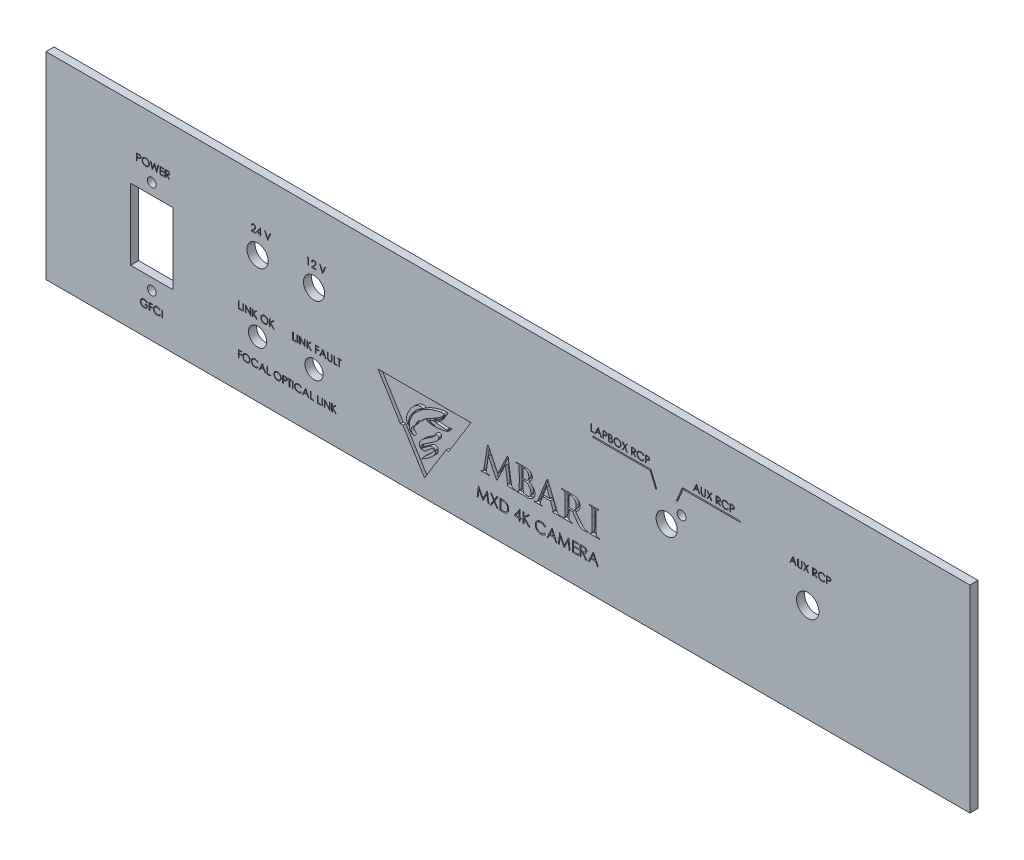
SolidWorks part; units mm, degrees
ref_plane "Front Plane" through (0, 0, 0) normal (0, 0, 1) x (1, 0, 0)
ref_plane "Top Plane" through (0, 0, 0) normal (0, 1, 0) x (1, 0, 0)
ref_plane "Right Plane" through (0, 0, 0) normal (1, 0, 0) x (0, 0, -1)
sketch "Sketch1" plane through (0, 0, 0) normal (0, 0, 1) x (1, 0, 0)
  line L1 (-207.9625, 44.45) -> (207.9625, 44.45)
  line L2 (-207.9625, 44.45) -> (-207.9625, -44.45)
  line L3 (-207.9625, -44.45) -> (207.9625, -44.45)
  line L4 (207.9625, 44.45) -> (207.9625, -44.45)
  line L5 (-207.9625, 44.45) -> (207.9625, -44.45) construction
  line L6 (-207.9625, -44.45) -> (207.9625, 44.45) construction
  point P0 (0, 0)
  dimension "D1" = 88.9
  dimension "D2" = 415.925
extrude "Boss-Extrude1" add sketch "Sketch1" along normal blind 3.6322
sketch "Sketch3" plane through (0, 0, 3.6322) normal (0, 0, 1) x (1, 0, 0)
  line L0 (-207.9625, 0) -> (207.9625, 0) construction
  line L1 (-207.9625, 44.45) -> (-207.9625, -44.45) construction
  line L2 (207.9625, -44.45) -> (207.9625, 44.45) construction
  line L3 (71.4375, 0) -> (84.0984, 12.6609) construction
  line L4 (-169.8625, 12.192) -> (-150.8125, 12.192)
  line L5 (-169.8625, 12.192) -> (-169.8625, -19.812)
  line L6 (-169.8625, -19.812) -> (-150.8125, -19.812)
  line L7 (-150.8125, 12.192) -> (-150.8125, -19.812)
  line L8 (-112.7125, 12.7) -> (-87.3125, 12.7) construction
  line L9 (-207.9625, -44.45) -> (207.9625, -44.45) construction
  line L10 (-112.7125, -19.05) -> (-87.3125, -19.05) construction
  line L11 (-87.3125, -19.05) -> (-87.3125, 12.7) construction
  line L12 (-112.7125, 12.7) -> (-112.7125, -19.05) construction
  line L13 (-169.8625, -3.81) -> (-150.8125, -3.81) construction
  line L14 (-177.6498, 31.623) -> (-140.7405, 31.623) construction
  line L15 (-160.3375, 21.274) -> (-160.3375, -30.0296) construction
  circle A0 centre (-112.7125, 12.7) radius 4.7625
  circle A1 centre (-87.3125, 12.7) radius 4.7625
  circle A2 centre (71.4375, 0) radius 4.7625
  circle A3 centre (78.1727, 6.7352) radius 1.9837
  circle A4 centre (71.4375, 0) radius 9.525 construction
  circle A5 centre (-112.7125, -19.05) radius 4.1021
  circle A6 centre (-87.3125, -19.05) radius 4.1021
  circle A7 centre (-160.3375, -24.892) radius 1.9812
  circle A8 centre (-160.3375, 17.272) radius 1.9812
  dimension "D5" = 9.525
  dimension "D6" = 9.525
  dimension "D9" = 9.525
  dimension "D12" = 3.9675
  dimension "D11" = 19.05
  dimension "D7" = 25.4
  dimension "D17" = 8.2042
  dimension "D18" = 8.2042
  dimension "D21" = 5.08
  dimension "D23" = 3.9624
  dimension "D24" = 3.9624
  dimension "D2" = 32.004
  dimension "D3" = 38.1
  dimension "D4" = 19.05
  dimension "D8" = 95.25
  dimension "D10" = 279.4
  dimension "D13" = 45
  dimension "D14" = 57.15
  dimension "D15" = 76.073
  dimension "D16" = 120.65
  dimension "D19" = 35.433
  dimension "D20" = 9.525
  dimension "D22" = 42.164
extrude "Cut-Extrude2" cut sketch "Sketch3" against normal through all
hole_wizard "X (0.397) Diameter Hole1" positions "Sketch4" profile "Sketch5" hole size "X" standard "ANSI Inch"
sketch "Sketch4" plane through (0, 0, 3.6322) normal (0, 0, 1) x (1, 0, 0)
  line L0 (-207.9625, 44.45) -> (-207.9625, -44.45) construction
  line L1 (-207.9625, 0) -> (207.9625, 0) construction
  line L2 (207.9625, -44.45) -> (207.9625, 44.45) construction
  point P0 (134.9375, 0)
  dimension "D1" = 342.9
sketch "Sketch5" plane through (134.9375, 0, 3.6322) normal (1, 0, 0) x (0, -1, 0)
  line L0 (0, 0) -> (0, 3.6322)
  line L1 (0, 3.6322) -> (5.0419, 3.6322)
  line L2 (5.0419, 3.6322) -> (5.0419, 0)
  line L5 (5.0419, 0) -> (0, 0)
  line L11 (0, -6.35) -> (0, 107.95) construction
  dimension "Thru Hole Dia." = 10.0838
  dimension "Thru Hole Depth" = 3.6322
sketch "Sketch2" plane through (0, 0, 3.6322) normal (0, 0, 1) x (1, 0, 0)
  line L0 (71.4375, 0) -> (71.4375, 30.1179) construction
  line L1 (75.9161, 11.4761) -> (78.4274, 17.5387)
  line L2 (78.662, 17.6955) -> (104.3712, 17.6955)
  line L6 (76.3854, 11.2817) -> (78.7668, 17.0307)
  line L7 (79.0015, 17.1875) -> (104.3712, 17.1875)
  line L13 (63.8735, 17.1875) -> (38.5038, 17.1875)
  line L14 (66.4896, 11.2817) -> (64.1082, 17.0307)
  line L15 (64.213, 17.6955) -> (38.5038, 17.6955)
  line L16 (66.9589, 11.4761) -> (64.4476, 17.5387)
  circle A0 centre (71.4375, 0) radius 12.319 construction
  circle A1 centre (71.4375, 0) radius 19.05 construction
  arc A2 (75.9161, 11.4761) -> (76.3854, 11.2817) centre (76.1508, 11.3789) ccw
  arc A3 (78.7668, 17.0307) -> (79.0015, 17.1875) centre (79.0015, 16.9335) cw
  arc A4 (78.4274, 17.5387) -> (78.662, 17.6955) centre (78.662, 17.4415) cw
  arc A5 (104.3712, 17.1875) -> (104.3712, 17.6955) centre (104.3712, 17.4415) ccw
  arc A6 (38.5038, 17.1875) -> (38.5038, 17.6955) centre (38.5038, 17.4415) cw
  arc A7 (64.4476, 17.5387) -> (64.213, 17.6955) centre (64.213, 17.4415) ccw
  arc A8 (64.1082, 17.0307) -> (63.8735, 17.1875) centre (63.8735, 16.9335) ccw
  arc A9 (66.9589, 11.4761) -> (66.4896, 11.2817) centre (66.7242, 11.3789) cw
  text T0 "POWER"
  text T1 "24 V"
  text T2 "12 V"
  text T3 "AUX RCP"
  text T4 "AUX RCP"
  text T5 "LAPBOX RCP"
  text T6 "FOCAL OPTICAL LINK"
  text T7 "LINK OK"
  text T8 "LINK FAULT"
  text T9 "GFCI"
  point P26 (78.8317, 17.1875)
  point P29 (78.4923, 17.6955)
  point P37 (64.3827, 17.6955)
  point P38 (64.0433, 17.1875)
  point P40 (-163.4462, -33.1202)
  point P41 (0, 0)
  point P42 (0, 0)
  point P43 (-164.9473, -32.5904)
  point P44 (-165.7421, -33.2085)
  dimension "D1" = 24.638
  dimension "D2" = 38.1
  dimension "D6" = 0.254
  dimension "D3" = 22.5
  dimension "D4" = 0.508
  dimension "D5" = 0.508
extrude "Cut-Extrude1" cut sketch "Sketch2" against normal blind 1.27
sketch "Sketch6" plane through (0, 0, 3.6322) normal (0, 0, 1) x (1, 0, 0)
  line L0 (-8.648, -9.8931) -> (-4.5542, -18.3512)
  line L1 (-4.5542, -18.3512) -> (-0.4751, -9.7882)
  line L2 (0.1248, -9.8931) -> (1.4897, -19.161)
  line L3 (-0.2353, -20.0305) -> (-1.1352, -13.4321)
  line L4 (-1.1352, -13.4321) -> (-1.1953, -13.4321)
  line L5 (-1.1953, -13.4321) -> (-4.4644, -20.2405)
  line L6 (-8.8282, -13.5973) -> (-8.8881, -13.5973)
  line L7 (-8.8881, -13.5973) -> (-9.668, -19.5655)
  line L8 (-10.7925, -19.5955) -> (-9.3079, -9.8184)
  line L9 (6.8754, -15.2919) -> (6.8754, -18.8459)
  line L10 (15.5613, -17.3016) -> (14.7513, -19.446)
  line L11 (15.1262, -20.8257) -> (15.3511, -20.8257)
  line L12 (13.5964, -19.446) -> (17.3606, -10.0284)
  line L13 (20.3904, -20.466) -> (19.1907, -17.2867)
  line L14 (18.8302, -16.3417) -> (17.4808, -12.6377)
  line L15 (17.3158, -12.6377) -> (15.9359, -16.3266)
  line L16 (35.7394, -21.0956) -> (34.3146, -21.0956)
  line L17 (28.9008, -16.4317) -> (27.5962, -16.4018)
  line L18 (27.476, -16.5217) -> (27.476, -16.7317)
  line L19 (39.6901, -14.1071) -> (39.6901, -16.7464)
  line L20 (-32.9372, -13.8237) -> (-32.9538, -13.9526)
  line L21 (-29.3165, -8.6069) -> (-29.1387, -8.7056)
  line L22 (-58.4834, -4.5643) -> (-48.4265, -20.8642)
  line L23 (-48.4265, -20.8642) -> (-47.2843, -20.8642)
  line L24 (-47.2843, -20.8642) -> (-37.5838, -36.5292)
  line L25 (-37.5838, -36.5292) -> (-27.8945, -20.8642)
  line L26 (-27.8945, -20.8642) -> (-26.7161, -20.8642)
  line L27 (-26.7161, -20.8642) -> (-16.6581, -4.5643)
  line L28 (-16.6581, -4.5643) -> (-58.4834, -4.5643)
  line L29 (-28.3688, -7.7097) -> (-28.542, -7.9559)
  line L30 (-37.0478, -13.2405) -> (-38.1851, -14.1243)
  line L31 (-32.2349, -12.228) -> (-32.9745, -12.0092)
  line L32 (-38.8678, -29.7655) -> (-37.2522, -27.8185)
  line L33 (-36.8523, -13.4076) -> (-36.3789, -13.1654)
  line L34 (-32.4053, -12.4742) -> (-27.4749, -12.8568)
  line L35 (-27.2878, -12.5555) -> (-27.0639, -12.8095)
  spline S0 degree 3 poles (-9.3079, -9.8184) (-9.2631, -9.5634) (-9.1731, -9.4283) (-9.0531, -9.4283) knots 0 0 0 0 1 1 1 1
  spline S1 degree 3 poles (-9.0531, -9.4283) (-8.9331, -9.4283) (-8.8433, -9.5033) (-8.648, -9.8931) knots 1 1 1 1 2 2 2 2
  spline S2 degree 3 poles (-0.4751, -9.7882) (-0.37, -9.5483) (-0.2801, -9.4283) (-0.1453, -9.4283) knots 4 4 4 4 5 5 5 5
  spline S3 degree 3 poles (-0.1453, -9.4283) (-0.0103, -9.4283) (0.0796, -9.5784) (0.1248, -9.8931) knots 5 5 5 5 6 6 6 6
  spline S4 degree 3 poles (1.4897, -19.161) (1.6245, -20.1057) (1.7742, -20.5408) (2.2243, -20.6758) knots 7 7 7 7 8 8 8 8
  spline S5 degree 3 poles (2.2243, -20.6758) (2.659, -20.8106) (2.959, -20.8255) (3.1539, -20.8255) knots 8 8 8 8 9 9 9 9
  spline S6 degree 3 poles (3.1539, -20.8255) (3.2892, -20.8255) (3.3939, -20.8406) (3.3939, -20.9306) knots 9 9 9 9 10 10 10 10
  spline S7 degree 3 poles (3.3939, -20.9306) (3.3939, -21.0506) (3.2142, -21.0956) (3.004, -21.0956) knots 10 10 10 10 11 11 11 11
  spline S8 degree 3 poles (3.004, -21.0956) (2.6292, -21.0956) (0.5594, -21.0506) (-0.0404, -21.0054) knots 11 11 11 11 12 12 12 12
  spline S9 degree 3 poles (-0.0404, -21.0054) (-0.3852, -20.9756) (-0.4753, -20.9306) (-0.4753, -20.8406) knots 12 12 12 12 13 13 13 13
  spline S10 degree 3 poles (-0.4753, -20.8406) (-0.4753, -20.7654) (-0.4154, -20.7204) (-0.3101, -20.6756) knots 13 13 13 13 14 14 14 14
  spline S11 degree 3 poles (-0.3101, -20.6756) (-0.2205, -20.6452) (-0.1752, -20.4505) (-0.2353, -20.0305) knots 14 14 14 14 15 15 15 15
  spline S12 degree 3 poles (-4.4644, -20.2405) (-4.8092, -20.9453) (-4.8844, -21.0803) (-5.0194, -21.0803) knots 18 18 18 18 19 19 19 19
  spline S13 degree 3 poles (-5.0194, -21.0803) (-5.1542, -21.0803) (-5.3044, -20.7803) (-5.5441, -20.3306) knots 19 19 19 19 20 20 20 20
  spline S14 degree 3 poles (-5.5441, -20.3306) (-5.904, -19.6407) (-7.0886, -17.346) (-7.2684, -16.9262) knots 20 20 20 20 21 21 21 21
  spline S15 degree 3 poles (-7.2684, -16.9262) (-7.4037, -16.6115) (-8.3034, -14.7218) (-8.8282, -13.5973) knots 21 21 21 21 22 22 22 22
  spline S16 degree 3 poles (-9.668, -19.5655) (-9.6982, -19.8356) (-9.713, -20.0305) (-9.713, -20.2705) knots 24 24 24 24 25 25 25 25
  spline S17 degree 3 poles (-9.713, -20.2705) (-9.713, -20.5554) (-9.5183, -20.6905) (-9.2631, -20.7503) knots 25 25 25 25 26 26 26 26
  spline S18 degree 3 poles (-9.2631, -20.7503) (-8.993, -20.8102) (-8.7832, -20.8251) (-8.6333, -20.8251) knots 26 26 26 26 27 27 27 27
  spline S19 degree 3 poles (-8.6333, -20.8251) (-8.5134, -20.8251) (-8.4083, -20.8552) (-8.4083, -20.9302) knots 27 27 27 27 28 28 28 28
  spline S20 degree 3 poles (-8.4083, -20.9302) (-8.4083, -21.065) (-8.5435, -21.0952) (-8.7682, -21.0952) knots 28 28 28 28 29 29 29 29
  spline S21 degree 3 poles (-8.7682, -21.0952) (-9.3981, -21.0952) (-10.0729, -21.0502) (-10.3428, -21.0502) knots 29 29 29 29 30 30 30 30
  spline S22 degree 3 poles (-10.3428, -21.0502) (-10.6276, -21.0502) (-11.3474, -21.0952) (-11.8272, -21.0952) knots 30 30 30 30 31 31 31 31
  spline S23 degree 3 poles (-11.8272, -21.0952) (-11.9774, -21.0952) (-12.0975, -21.065) (-12.0975, -20.9302) knots 31 31 31 31 32 32 32 32
  spline S24 degree 3 poles (-12.0975, -20.9302) (-12.0975, -20.8552) (-12.0073, -20.8251) (-11.8576, -20.8251) knots 32 32 32 32 33 33 33 33
  spline S25 degree 3 poles (-11.8576, -20.8251) (-11.7376, -20.8251) (-11.6325, -20.8251) (-11.4075, -20.7801) knots 33 33 33 33 34 34 34 34
  spline S26 degree 3 poles (-11.4075, -20.7801) (-10.9877, -20.6903) (-10.8675, -20.1051) (-10.7925, -19.5955) knots 34 34 34 34 35 35 35 35
  spline S27 degree 3 poles (5.0458, -10.9278) (5.0158, -10.4182) (4.8959, -10.1781) (4.4009, -10.0732) knots 1 1 1 1 2 2 2 2
  spline S28 degree 3 poles (4.4009, -10.0732) (4.281, -10.043) (4.0257, -10.0282) (3.8159, -10.0282) knots 2 2 2 2 3 3 3 3
  spline S29 degree 3 poles (3.8159, -10.0282) (3.651, -10.0282) (3.5613, -9.9984) (3.5613, -9.8931) knots 3 3 3 3 4 4 4 4
  spline S30 degree 3 poles (3.5613, -9.8931) (3.5613, -9.7882) (3.666, -9.7583) (3.8909, -9.7583) knots 4 4 4 4 5 5 5 5
  spline S31 degree 3 poles (3.8909, -9.7583) (4.6859, -9.7583) (5.6307, -9.8031) (5.9304, -9.8031) knots 5 5 5 5 6 6 6 6
  spline S32 degree 3 poles (5.9304, -9.8031) (6.6654, -9.8031) (7.2502, -9.7583) (7.7602, -9.7583) knots 6 6 6 6 7 7 7 7
  spline S33 degree 3 poles (7.7602, -9.7583) (10.4743, -9.7583) (10.9544, -11.2128) (10.9544, -12.0075) knots 7 7 7 7 8 8 8 8
  spline S34 degree 3 poles (10.9544, -12.0075) (10.9544, -13.2376) (10.2494, -13.9722) (9.4247, -14.6322) knots 8 8 8 8 9 9 9 9
  spline S35 degree 3 poles (9.4247, -14.6322) (10.6545, -15.052) (12.154, -16.117) (12.154, -17.8715) knots 9 9 9 9 10 10 10 10
  spline S36 degree 3 poles (12.154, -17.8715) (12.154, -19.4761) (10.9093, -21.1406) (8.1499, -21.1406) knots 10 10 10 10 11 11 11 11
  spline S37 degree 3 poles (8.1499, -21.1406) (7.79, -21.1406) (6.4255, -21.0506) (5.9756, -21.0506) knots 11 11 11 11 12 12 12 12
  spline S38 degree 3 poles (5.9756, -21.0506) (5.6305, -21.0506) (4.6857, -21.0956) (4.086, -21.0956) knots 12 12 12 12 13 13 13 13
  spline S39 degree 3 poles (4.086, -21.0956) (3.8909, -21.0956) (3.786, -21.0506) (3.786, -20.9455) knots 13 13 13 13 14 14 14 14
  spline S40 degree 3 poles (3.786, -20.9455) (3.786, -20.8707) (3.8463, -20.8255) (4.0259, -20.8255) knots 14 14 14 14 15 15 15 15
  spline S41 degree 3 poles (4.0259, -20.8255) (4.251, -20.8255) (4.4309, -20.7956) (4.5659, -20.7654) knots 15 15 15 15 16 16 16 16
  spline S42 degree 3 poles (4.5659, -20.7654) (4.8657, -20.7053) (4.9411, -20.3758) (5.0008, -19.9409) knots 16 16 16 16 17 17 17 17
  spline S43 degree 3 poles (5.0008, -19.9409) (5.1789, -18.1604) (5.1174, -14.8189) (5.0458, -10.9278) knots 17 17 17 17 18 18 18 18
  spline S44 degree 3 poles (6.8754, -14.3621) (6.8754, -14.4821) (6.9205, -14.5122) (6.9805, -14.5269) knots 0 0 0 0 1 1 1 1
  spline S45 degree 3 poles (6.9805, -14.5269) (7.1154, -14.5572) (7.3404, -14.5721) (7.6851, -14.5721) knots 1 1 1 1 2 2 2 2
  spline S46 degree 3 poles (7.6851, -14.5721) (8.1802, -14.5721) (8.5098, -14.512) (8.765, -14.2869) knots 2 2 2 2 3 3 3 3
  spline S47 degree 3 poles (8.765, -14.2869) (9.1548, -13.9722) (9.3801, -13.4321) (9.3801, -12.6974) knots 3 3 3 3 4 4 4 4
  spline S48 degree 3 poles (9.3801, -12.6974) (9.3801, -11.6926) (8.7951, -10.3728) (7.5054, -10.3728) knots 4 4 4 4 5 5 5 5
  spline S49 degree 3 poles (7.5054, -10.3728) (7.2954, -10.3728) (7.1606, -10.3728) (7.0105, -10.4029) knots 5 5 5 5 6 6 6 6
  spline S50 degree 3 poles (7.0105, -10.4029) (6.9056, -10.4331) (6.8754, -10.4927) (6.8754, -10.6579) knots 6 6 6 6 7 7 7 7
  spline S51 degree 2 poles (6.8754, -10.6579) (6.8754, -14.3621) (6.8754, -14.3621) knots 7 7 7 8 8 8
  spline S52 degree 3 poles (8.855, -15.5618) (8.5401, -15.3369) (8.1953, -15.232) (7.6103, -15.2019) knots 0 0 0 0 1 1 1 1
  spline S53 degree 3 poles (7.6103, -15.2019) (7.3404, -15.1868) (7.1903, -15.1868) (6.9655, -15.1868) knots 1 1 1 1 2 2 2 2
  spline S54 degree 3 poles (6.9655, -15.1868) (6.9054, -15.1868) (6.8754, -15.2172) (6.8754, -15.2919) knots 2 2 2 2 3 3 3 3
  spline S55 degree 3 poles (6.8754, -18.8459) (6.8754, -19.8358) (6.9205, -20.0906) (7.4005, -20.2856) knots 4 4 4 4 5 5 5 5
  spline S56 degree 3 poles (7.4005, -20.2856) (7.8055, -20.4505) (8.1501, -20.4654) (8.4951, -20.4654) knots 5 5 5 5 6 6 6 6
  spline S57 degree 3 poles (8.4951, -20.4654) (9.1701, -20.4654) (10.3097, -20.1055) (10.3097, -18.5459) knots 6 6 6 6 7 7 7 7
  spline S58 degree 3 poles (10.3097, -18.5459) (10.3095, -17.6165) (9.9948, -16.357) (8.855, -15.5618) knots 7 7 7 7 8 8 8 8
  spline S59 degree 3 poles (15.6961, -17.1817) (15.6212, -17.1817) (15.5908, -17.2116) (15.5613, -17.3016) knots 0 0 0 0 1 1 1 1
  spline S60 degree 3 poles (14.7513, -19.446) (14.6016, -19.8212) (14.5268, -20.1811) (14.5268, -20.3609) knots 2 2 2 2 3 3 3 3
  spline S61 degree 3 poles (14.5268, -20.3609) (14.5268, -20.631) (14.6614, -20.8257) (15.1262, -20.8257) knots 3 3 3 3 4 4 4 4
  spline S62 degree 3 poles (15.3511, -20.8257) (15.531, -20.8257) (15.5762, -20.8559) (15.5762, -20.9457) knots 5 5 5 5 6 6 6 6
  spline S63 degree 3 poles (15.5762, -20.9457) (15.5762, -21.0656) (15.4864, -21.0958) (15.3212, -21.0958) knots 6 6 6 6 7 7 7 7
  spline S64 degree 3 poles (15.3212, -21.0958) (14.8415, -21.0958) (14.1962, -21.0508) (13.7312, -21.0508) knots 7 7 7 7 8 8 8 8
  spline S65 degree 3 poles (13.7312, -21.0508) (13.5665, -21.0508) (12.7415, -21.0958) (11.9619, -21.0958) knots 8 8 8 8 9 9 9 9
  spline S66 degree 3 poles (11.9619, -21.0958) (11.7667, -21.0958) (11.6769, -21.0656) (11.6769, -20.9457) knots 9 9 9 9 10 10 10 10
  spline S67 degree 3 poles (11.6769, -20.9457) (11.6769, -20.8559) (11.737, -20.8257) (11.857, -20.8257) knots 10 10 10 10 11 11 11 11
  spline S68 degree 3 poles (11.857, -20.8257) (11.9918, -20.8257) (12.2018, -20.8108) (12.322, -20.7958) knots 11 11 11 11 12 12 12 12
  spline S69 degree 3 poles (12.322, -20.7958) (13.0116, -20.7055) (13.2966, -20.1959) (13.5964, -19.446) knots 12 12 12 12 13 13 13 13
  spline S70 degree 3 poles (17.3606, -10.0284) (17.5409, -9.5935) (17.6307, -9.4285) (17.7808, -9.4285) knots 14 14 14 14 15 15 15 15
  spline S71 degree 3 poles (17.7808, -9.4285) (17.9157, -9.4285) (18.0059, -9.5636) (18.1556, -9.9084) knots 15 15 15 15 16 16 16 16
  spline S72 degree 3 poles (18.1556, -9.9084) (18.5157, -10.7333) (20.9149, -16.8519) (21.8748, -19.1315) knots 16 16 16 16 17 17 17 17
  spline S73 degree 3 poles (21.8748, -19.1315) (22.4451, -20.4809) (22.8796, -20.6911) (23.1945, -20.7658) knots 17 17 17 17 18 18 18 18
  spline S74 degree 3 poles (23.1945, -20.7658) (23.4196, -20.8108) (23.6444, -20.8259) (23.824, -20.8259) knots 18 18 18 18 19 19 19 19
  spline S75 degree 3 poles (23.824, -20.8259) (23.944, -20.8259) (24.0194, -20.841) (24.0194, -20.9459) knots 19 19 19 19 20 20 20 20
  spline S76 degree 3 poles (24.0194, -20.9459) (24.0194, -21.0659) (23.8848, -21.096) (23.3295, -21.096) knots 20 20 20 20 21 21 21 21
  spline S77 degree 3 poles (23.3295, -21.096) (22.7894, -21.096) (21.6948, -21.096) (20.4955, -21.0659) knots 21 21 21 21 22 22 22 22
  spline S78 degree 3 poles (20.4955, -21.0659) (20.225, -21.051) (20.0456, -21.051) (20.0456, -20.9459) knots 22 22 22 22 23 23 23 23
  spline S79 degree 3 poles (20.0456, -20.9459) (20.0456, -20.8561) (20.105, -20.8259) (20.2554, -20.8111) knots 23 23 23 23 24 24 24 24
  spline S80 degree 3 poles (20.2554, -20.8111) (20.3605, -20.7809) (20.4654, -20.6459) (20.3904, -20.466) knots 24 24 24 24 25 25 25 25
  spline S81 degree 3 poles (19.1907, -17.2867) (19.1608, -17.212) (19.1162, -17.1821) (19.041, -17.1821) knots 26 26 26 26 27 27 27 27
  spline S82 degree 2 poles (19.041, -17.1821) (15.6961, -17.1821) (15.6961, -17.1817) knots 27 27 27 28 28 28
  spline S83 degree 3 poles (18.7552, -16.4317) (18.8302, -16.4317) (18.8459, -16.3865) (18.8302, -16.3417) knots 0 0 0 0 1 1 1 1
  spline S84 degree 3 poles (17.4808, -12.6377) (17.4655, -12.5776) (17.4504, -12.5025) (17.406, -12.5025) knots 2 2 2 2 3 3 3 3
  spline S85 degree 3 poles (17.406, -12.5025) (17.3606, -12.5025) (17.3309, -12.5774) (17.3158, -12.6377) knots 3 3 3 3 4 4 4 4
  spline S86 degree 3 poles (15.9359, -16.3266) (15.9212, -16.3865) (15.9359, -16.4315) (15.9959, -16.4315) knots 5 5 5 5 6 6 6 6
  spline S87 degree 2 poles (15.9959, -16.4315) (18.7552, -16.4315) (18.7552, -16.4317) knots 6 6 6 7 7 7
  spline S88 degree 3 poles (25.7062, -14.1071) (25.7062, -11.8277) (25.7062, -11.4079) (25.6767, -10.9278) knots 0 0 0 0 1 1 1 1
  spline S89 degree 3 poles (25.6767, -10.9278) (25.6468, -10.4182) (25.5268, -10.1781) (25.0317, -10.0732) knots 1 1 1 1 2 2 2 2
  spline S90 degree 3 poles (25.0317, -10.0732) (24.9117, -10.043) (24.6567, -10.0282) (24.4471, -10.0282) knots 2 2 2 2 3 3 3 3
  spline S91 degree 3 poles (24.4471, -10.0282) (24.2821, -10.0282) (24.1917, -9.9984) (24.1917, -9.8931) knots 3 3 3 3 4 4 4 4
  spline S92 degree 3 poles (24.1917, -9.8931) (24.1917, -9.7882) (24.297, -9.7583) (24.5219, -9.7583) knots 4 4 4 4 5 5 5 5
  spline S93 degree 3 poles (24.5219, -9.7583) (25.3166, -9.7583) (26.2615, -9.8031) (26.5762, -9.8031) knots 5 5 5 5 6 6 6 6
  spline S94 degree 3 poles (26.5762, -9.8031) (27.0866, -9.8031) (28.2256, -9.7583) (28.6908, -9.7583) knots 6 6 6 6 7 7 7 7
  spline S95 degree 3 poles (28.6908, -9.7583) (29.6359, -9.7583) (30.6406, -9.8481) (31.4505, -10.4031) knots 7 7 7 7 8 8 8 8
  spline S96 degree 3 poles (31.4505, -10.4031) (31.8701, -10.6881) (32.4699, -11.4529) (32.4699, -12.4577) knots 8 8 8 8 9 9 9 9
  spline S97 degree 3 poles (32.4699, -12.4577) (32.4699, -13.5671) (32.0055, -14.587) (30.4905, -15.8168) knots 9 9 9 9 10 10 10 10
  spline S98 degree 3 poles (30.4905, -15.8168) (31.8253, -17.4963) (32.8602, -18.8308) (33.7445, -19.7607) knots 10 10 10 10 11 11 11 11
  spline S99 degree 3 poles (33.7445, -19.7607) (34.5845, -20.6306) (35.1997, -20.7357) (35.4243, -20.7805) knots 11 11 11 11 12 12 12 12
  spline S100 degree 3 poles (35.4243, -20.7805) (35.5891, -20.8106) (35.7245, -20.8255) (35.8443, -20.8255) knots 12 12 12 12 13 13 13 13
  spline S101 degree 3 poles (35.8443, -20.8255) (35.9645, -20.8255) (36.0239, -20.8705) (36.0239, -20.9455) knots 13 13 13 13 14 14 14 14
  spline S102 degree 3 poles (36.0239, -20.9455) (36.0239, -21.0654) (35.9192, -21.0956) (35.7394, -21.0956) knots 14 14 14 14 15 15 15 15
  spline S103 degree 3 poles (34.3146, -21.0956) (33.4749, -21.0956) (33.0999, -21.0204) (32.7098, -20.8106) knots 16 16 16 16 17 17 17 17
  spline S104 degree 3 poles (32.7098, -20.8106) (32.0648, -20.4656) (31.4951, -19.7609) (30.6553, -18.606) knots 17 17 17 17 18 18 18 18
  spline S105 degree 3 poles (30.6553, -18.606) (30.0557, -17.7813) (29.3658, -16.7617) (29.1707, -16.5368) knots 18 18 18 18 19 19 19 19
  spline S106 degree 3 poles (29.1707, -16.5368) (29.0957, -16.4466) (29.0061, -16.4317) (28.9008, -16.4317) knots 19 19 19 19 20 20 20 20
  spline S107 degree 3 poles (27.5962, -16.4018) (27.5215, -16.4018) (27.476, -16.4317) (27.476, -16.5217) knots 21 21 21 21 22 22 22 22
  spline S108 degree 3 poles (27.476, -16.7317) (27.476, -18.1263) (27.476, -19.3111) (27.5512, -19.9411) knots 23 23 23 23 24 24 24 24
  spline S109 degree 3 poles (27.5512, -19.9411) (27.5962, -20.376) (27.6865, -20.7057) (28.136, -20.7656) knots 24 24 24 24 25 25 25 25
  spline S110 degree 3 poles (28.136, -20.7656) (28.361, -20.7958) (28.6906, -20.8257) (28.8709, -20.8257) knots 25 25 25 25 26 26 26 26
  spline S111 degree 3 poles (28.8709, -20.8257) (28.9906, -20.8257) (29.0505, -20.8707) (29.0505, -20.9457) knots 26 26 26 26 27 27 27 27
  spline S112 degree 3 poles (29.0505, -20.9457) (29.0505, -21.0508) (28.9456, -21.0958) (28.7507, -21.0958) knots 27 27 27 27 28 28 28 28
  spline S113 degree 3 poles (28.7507, -21.0958) (27.8812, -21.0958) (26.7709, -21.0508) (26.546, -21.0508) knots 28 28 28 28 29 29 29 29
  spline S114 degree 3 poles (26.546, -21.0508) (26.2615, -21.0508) (25.3166, -21.0958) (24.7168, -21.0958) knots 29 29 29 29 30 30 30 30
  spline S115 degree 3 poles (24.7168, -21.0958) (24.5219, -21.0958) (24.4165, -21.0508) (24.4165, -20.9457) knots 30 30 30 30 31 31 31 31
  spline S116 degree 3 poles (24.4165, -20.9457) (24.4165, -20.8709) (24.4766, -20.8257) (24.6565, -20.8257) knots 31 31 31 31 32 32 32 32
  spline S117 degree 3 poles (24.6565, -20.8257) (24.8816, -20.8257) (25.0618, -20.7958) (25.1964, -20.7656) knots 32 32 32 32 33 33 33 33
  spline S118 degree 3 poles (25.1964, -20.7656) (25.4967, -20.7055) (25.5712, -20.376) (25.6311, -19.9411) knots 33 33 33 33 34 34 34 34
  spline S119 degree 3 poles (25.6311, -19.9411) (25.7058, -19.3111) (25.7058, -18.1263) (25.7058, -16.7466) knots 34 34 34 34 35 35 35 35
  spline S120 degree 2 poles (25.7058, -16.7466) (25.7058, -14.1071) (25.7062, -14.1071) knots 35 35 35 36 36 36
  spline S121 degree 3 poles (27.476, -15.2921) (27.476, -15.4571) (27.5058, -15.5172) (27.6111, -15.562) knots 0 0 0 0 1 1 1 1
  spline S122 degree 3 poles (27.6111, -15.562) (27.9264, -15.6669) (28.3759, -15.7121) (28.7509, -15.7121) knots 1 1 1 1 2 2 2 2
  spline S123 degree 3 poles (28.7509, -15.7121) (29.3507, -15.7121) (29.5454, -15.6522) (29.8157, -15.4573) knots 2 2 2 2 3 3 3 3
  spline S124 degree 3 poles (29.8157, -15.4573) (30.265, -15.1271) (30.7007, -14.4375) (30.7007, -13.2076) knots 3 3 3 3 4 4 4 4
  spline S125 degree 3 poles (30.7007, -13.2076) (30.7007, -11.0786) (29.291, -10.4634) (28.4065, -10.4634) knots 4 4 4 4 5 5 5 5
  spline S126 degree 3 poles (28.4065, -10.4634) (28.0313, -10.4634) (27.7612, -10.4785) (27.6111, -10.5235) knots 5 5 5 5 6 6 6 6
  spline S127 degree 3 poles (27.6111, -10.5235) (27.5058, -10.5535) (27.476, -10.6133) (27.476, -10.7333) knots 6 6 6 6 7 7 7 7
  spline S128 degree 2 poles (27.476, -10.7333) (27.476, -15.2921) (27.476, -15.2921) knots 7 7 7 8 8 8
  spline S129 degree 3 poles (37.8299, -14.1071) (37.8299, -11.8277) (37.8299, -11.4079) (37.8002, -10.9278) knots 0 0 0 0 1 1 1 1
  spline S130 degree 3 poles (37.8002, -10.9278) (37.7707, -10.4182) (37.6203, -10.163) (37.2906, -10.088) knots 1 1 1 1 2 2 2 2
  spline S131 degree 3 poles (37.2906, -10.088) (37.1254, -10.0432) (36.9307, -10.0282) (36.7504, -10.0282) knots 2 2 2 2 3 3 3 3
  spline S132 degree 3 poles (36.7504, -10.0282) (36.6007, -10.0282) (36.5105, -9.9984) (36.5105, -9.8783) knots 3 3 3 3 4 4 4 4
  spline S133 degree 3 poles (36.5105, -9.8783) (36.5105, -9.7882) (36.6304, -9.7583) (36.8704, -9.7583) knots 4 4 4 4 5 5 5 5
  spline S134 degree 3 poles (36.8704, -9.7583) (37.4405, -9.7583) (38.3854, -9.8031) (38.8202, -9.8031) knots 5 5 5 5 6 6 6 6
  spline S135 degree 3 poles (38.8202, -9.8031) (39.195, -9.8031) (40.08, -9.7583) (40.6501, -9.7583) knots 6 6 6 6 7 7 7 7
  spline S136 degree 3 poles (40.6501, -9.7583) (40.8448, -9.7583) (40.9646, -9.7882) (40.9646, -9.8783) knots 7 7 7 7 8 8 8 8
  spline S137 degree 3 poles (40.9646, -9.8783) (40.9646, -9.9984) (40.8746, -10.0282) (40.7248, -10.0282) knots 8 8 8 8 9 9 9 9
  spline S138 degree 3 poles (40.7248, -10.0282) (40.5747, -10.0282) (40.4548, -10.0432) (40.2747, -10.0732) knots 9 9 9 9 10 10 10 10
  spline S139 degree 3 poles (40.2747, -10.0732) (39.8696, -10.1479) (39.7496, -10.4031) (39.7201, -10.9278) knots 10 10 10 10 11 11 11 11
  spline S140 degree 3 poles (39.7201, -10.9278) (39.6901, -11.4077) (39.6901, -11.8277) (39.6901, -14.1071) knots 11 11 11 11 12 12 12 12
  spline S141 degree 3 poles (39.6901, -16.7464) (39.6901, -18.2011) (39.6901, -19.3857) (39.7496, -20.0307) knots 13 13 13 13 14 14 14 14
  spline S142 degree 3 poles (39.7496, -20.0307) (39.7948, -20.4357) (39.8997, -20.7055) (40.3494, -20.7654) knots 14 14 14 14 15 15 15 15
  spline S143 degree 3 poles (40.3494, -20.7654) (40.5597, -20.7956) (40.8898, -20.8255) (41.1143, -20.8255) knots 15 15 15 15 16 16 16 16
  spline S144 degree 3 poles (41.1143, -20.8255) (41.2795, -20.8255) (41.3542, -20.8705) (41.3542, -20.9455) knots 16 16 16 16 17 17 17 17
  spline S145 degree 3 poles (41.3542, -20.9455) (41.3542, -21.0506) (41.2344, -21.0956) (41.069, -21.0956) knots 17 17 17 17 18 18 18 18
  spline S146 degree 3 poles (41.069, -21.0956) (40.0796, -21.0956) (39.1349, -21.0506) (38.7302, -21.0506) knots 18 18 18 18 19 19 19 19
  spline S147 degree 3 poles (38.7302, -21.0506) (38.3854, -21.0506) (37.4403, -21.0956) (36.8404, -21.0956) knots 19 19 19 19 20 20 20 20
  spline S148 degree 3 poles (36.8404, -21.0956) (36.6455, -21.0956) (36.5404, -21.0506) (36.5404, -20.9455) knots 20 20 20 20 21 21 21 21
  spline S149 degree 3 poles (36.5404, -20.9455) (36.5404, -20.8707) (36.6007, -20.8255) (36.7803, -20.8255) knots 21 21 21 21 22 22 22 22
  spline S150 degree 3 poles (36.7803, -20.8255) (37.0056, -20.8255) (37.1855, -20.7956) (37.3203, -20.7654) knots 22 22 22 22 23 23 23 23
  spline S151 degree 3 poles (37.3203, -20.7654) (37.6201, -20.7053) (37.7097, -20.4505) (37.7549, -20.0159) knots 23 23 23 23 24 24 24 24
  spline S152 degree 3 poles (37.7549, -20.0159) (37.8295, -19.3857) (37.8295, -18.2011) (37.8295, -16.7464) knots 24 24 24 24 25 25 25 25
  spline S153 degree 2 poles (37.8295, -16.7464) (37.8295, -14.1071) (37.8299, -14.1071) knots 25 25 25 26 26 26
  spline S154 degree 3 poles (-29.6046, -7.7025) (-29.6625, -7.6641) (-29.7739, -7.6641) (-29.8591, -7.6641) (-30.034, -7.6641) (-30.1793, -7.7738) (-30.1793, -7.8935) (-30.1793, -8.0122) (-30.034, -8.0996) (-29.8591, -8.0996) knots 2 2 2 2 3 3 3 4 4 4 5 5 5 5
  spline S155 degree 3 poles (-29.5289, -7.8768) (-29.5289, -7.8156) (-29.5444, -7.7409) (-29.6046, -7.7025) knots 1 1 1 1 2 2 2 2
  spline S156 degree 3 poles (-29.8591, -8.0996) (-29.6837, -8.0996) (-29.5294, -7.9949) (-29.5289, -7.8768) knots 0 0 0 0 1 1 1 1
  spline S157 degree 3 poles (-43.2486, -11.9824) (-42.4054, -10.8925) (-40.4623, -9.1054) (-37.9901, -9.7091) knots 0 0 0 0 1 1 1 1
  spline S158 degree 2 poles (-37.9901, -9.7091) (-40.4072, -10.8491) (-42.2005, -12.9626) knots 1 1 1 2 2 2
  spline S159 degree 3 poles (-42.2005, -12.9626) (-42.7997, -13.6693) (-43.5566, -14.7331) (-43.9926, -15.6336) knots 2 2 2 2 3 3 3 3
  spline S160 degree 3 poles (-43.9926, -15.6336) (-43.9926, -15.6336) (-45.0402, -17.5611) (-44.8375, -19.6239) knots 3 3 3 3 4 4 4 4
  spline S161 degree 2 poles (-44.8375, -19.6239) (-47.049, -16.8922) (-43.2486, -11.9824) knots 4 4 4 5 5 5
  spline S162 degree 2 poles (-44.4309, -19.6) (-44.2967, -15.4649) (-40.7463, -12.2531) knots 0 0 0 1 1 1
  spline S163 degree 2 poles (-40.7463, -12.2531) (-37.0762, -8.5858) (-30.2473, -7.1896) knots 1 1 1 2 2 2
  spline S164 degree 2 poles (-30.2473, -7.1896) (-30.0763, -7.1317) (-29.0187, -7.2475) knots 2 2 2 3 3 3
  spline S165 degree 2 poles (-29.0187, -7.2475) (-28.7909, -7.2369) (-28.7152, -7.2475) knots 3 3 3 4 4 4
  spline S166 degree 2 poles (-28.7152, -7.2475) (-28.2591, -7.311) (-28.3688, -7.7097) knots 4 4 4 5 5 5
  spline S167 degree 3 poles (-28.542, -7.9559) (-28.5576, -7.8111) (-28.7553, -7.7766) (-28.8895, -7.869) knots 6 6 6 6 7 7 7 7
  spline S168 degree 2 poles (-28.8895, -7.869) (-28.9892, -7.9381) (-29.149, -8.1135) knots 7 7 7 8 8 8
  spline S169 degree 2 poles (-29.149, -8.1135) (-29.9103, -9.038) (-30.073, -9.0954) knots 8 8 8 9 9 9
  spline S170 degree 2 poles (-30.073, -9.0954) (-31.4736, -10.251) (-37.0478, -13.2405) knots 9 9 9 10 10 10
  spline S171 degree 2 poles (-38.1851, -14.1243) (-38.5276, -15.0995) (-39.9093, -15.3885) knots 11 11 11 12 12 12
  spline S172 degree 3 poles (-39.9093, -15.3885) (-40.905, -16.1059) (-41.1629, -16.8349) (-41.2643, -17.1774) knots 12 12 12 12 13 13 13 13
  spline S173 degree 2 poles (-41.2643, -17.1774) (-41.5093, -18.0116) (-42.2784, -18.6983) knots 13 13 13 14 14 14
  spline S174 degree 2 poles (-42.2784, -18.6983) (-42.6304, -18.9879) (-43.067, -19.4028) knots 14 14 14 15 15 15
  spline S175 degree 2 poles (-43.067, -19.4028) (-44.3986, -20.9761) (-42.3169, -22.4197) knots 15 15 15 16 16 16
  spline S176 degree 3 poles (-42.3169, -22.4197) (-44.1279, -22.227) (-44.4599, -20.4805) (-44.4309, -19.6) knots 16 16 16 16 17 17 17 17
  spline S177 degree 2 poles (-29.1387, -8.7056) (-29.3035, -9.0027) (-29.584, -9.5231) knots 1.34521 1.34521 1.34521 2 2 2
  spline S178 degree 2 poles (-29.584, -9.5231) (-30.2149, -10.8803) (-32.2349, -12.228) knots 2 2 2 3 3 3
  spline S179 degree 3 poles (-32.9745, -12.0092) (-32.6894, -11.8972) (-31.2542, -10.9466) (-30.7836, -10.53) knots 4 4 4 4 5 5 5 5
  spline S180 degree 3 poles (-30.7836, -10.53) (-30.4166, -10.2053) (-29.7366, -9.2274) (-29.4381, -8.7785) knots 5 5 5 5 6 6 6 6
  spline S181 degree 2 poles (-29.4381, -8.7785) (-29.38, -8.691) (-29.3165, -8.6069) knots 6 6 6 6.216847 6.216847 6.216847
  spline S191 degree 3 poles (-32.7523, -24.6535) (-32.8375, -25.0712) (-32.9728, -25.3875) (-34.0555, -26.415) knots 0 0 0 0 1 1 1 1
  spline S192 degree 3 poles (-34.0555, -26.415) (-35.1287, -27.4336) (-36.6702, -28.6655) (-38.8678, -29.7655) knots 1 1 1 1 2 2 2 2
  spline S193 degree 3 poles (-37.2522, -27.8185) (-36.781, -27.3913) (-35.5174, -26.3293) (-35.2913, -26.1149) knots 3 3 3 3 4 4 4 4
  spline S194 degree 3 poles (-35.2913, -26.1149) (-34.5456, -25.4048) (-33.562, -24.6719) (-33.2647, -23.5926) knots 4 4 4 4 5 5 5 5
  spline S195 degree 2 poles (-33.2647, -23.5926) (-32.9979, -23.5681) (-32.828, -23.8437) knots 5 5 5 6 6 6
  spline S196 degree 3 poles (-32.828, -23.8437) (-32.7289, -24.0041) (-32.6738, -24.267) (-32.7523, -24.6535) knots 6 6 6 6 7 7 7 7
  spline S197 degree 3 poles (-34.4058, -23.5602) (-35.372, -24.1522) (-36.017, -24.9308) (-36.5806, -25.4398) knots 0 0 0 0 1 1 1 1
  spline S198 degree 3 poles (-36.5806, -25.4398) (-37.3369, -26.1232) (-37.8576, -26.1393) (-38.263, -26.0742) knots 1 1 1 1 2 2 2 2
  spline S199 degree 2 poles (-38.263, -26.0742) (-38.7832, -25.9917) (-38.8311, -25.3997) knots 2 2 2 3 3 3
  spline S200 degree 3 poles (-38.8311, -25.3997) (-38.6818, -25.4855) (-38.4134, -25.3246) (-38.3176, -25.2605) knots 3 3 3 3 4 4 4 4
  spline S201 degree 3 poles (-38.3176, -25.2605) (-37.8453, -24.9459) (-36.8501, -24.1356) (-36.3355, -23.7607) knots 4 4 4 4 5 5 5 5
  spline S202 degree 3 poles (-36.3355, -23.7607) (-35.8688, -23.421) (-35.3063, -23.0156) (-34.9861, -22.8719) knots 5 5 5 5 6 6 6 6
  spline S203 degree 3 poles (-34.9861, -22.8719) (-34.2682, -22.5506) (-33.8093, -22.6274) (-33.4328, -22.7109) knots 6 6 6 6 7 7 7 7
  spline S204 degree 2 poles (-33.4328, -22.7109) (-32.8542, -22.8396) (-32.6504, -23.4884) knots 7 7 7 8 8 8
  spline S205 degree 3 poles (-32.6504, -23.4884) (-33.0358, -23.0529) (-34.0516, -23.3425) (-34.4058, -23.5602) knots 8 8 8 8 9 9 9 9
  spline S206 degree 3 poles (-33.0825, -20.2349) (-34.545, -21.3058) (-37.6549, -23.2411) (-38.2229, -23.744) knots 0 0 0 0 1 1 1 1
  spline S207 degree 3 poles (-38.2229, -23.744) (-38.4702, -23.964) (-39.8686, -25.1586) (-39.0405, -25.96) knots 1 1 1 1 2 2 2 2
  spline S208 degree 2 poles (-39.0405, -25.96) (-39.6169, -25.7378) (-39.8157, -25.0417) knots 2 2 2 3 3 3
  spline S209 degree 3 poles (-39.8157, -25.0417) (-39.9923, -24.4224) (-40.0847, -23.7775) (-38.9452, -22.4932) knots 3 3 3 3 4 4 4 4
  spline S210 degree 3 poles (-38.9452, -22.4932) (-38.2452, -21.704) (-36.2726, -20.2767) (-35.1331, -19.5928) knots 4 4 4 4 5 5 5 5
  spline S211 degree 3 poles (-35.1331, -19.5928) (-34.432, -19.1723) (-33.4958, -18.4945) (-33.1026, -18.0183) knots 5 5 5 5 6 6 6 6
  spline S212 degree 3 poles (-33.1026, -18.0183) (-32.9394, -17.819) (-32.5451, -17.472) (-32.6086, -16.9368) knots 6 6 6 6 7 7 7 7
  spline S213 degree 2 poles (-32.6086, -16.9368) (-31.5009, -16.6689) (-31.0938, -17.56) knots 7 7 7 8 8 8
  spline S214 degree 2 poles (-31.0938, -17.56) (-31.1662, -18.8303) (-33.0825, -20.2349) knots 8 8 8 9 9 9
  spline S215 degree 2 poles (-26.7303, -12.9281) (-26.8316, -13.0272) (-27.1123, -13.1598) knots 0 0 0 1 1 1
  spline S216 degree 2 poles (-27.1123, -13.1598) (-28.4851, -13.871) (-31.4959, -14.1355) knots 1 1 1 2 2 2
  spline S217 degree 2 poles (-31.4959, -14.1355) (-35.4829, -14.4825) (-36.8523, -13.4076) knots 2 2 2 3 3 3
  spline S218 degree 2 poles (-36.3789, -13.1654) (-34.9325, -13.921) (-32.9538, -13.9526) knots 4 4 4 4.77139 4.77139 4.77139
  spline S219 degree 2 poles (-32.9372, -13.8237) (-34.4738, -13.6262) (-35.5519, -12.9738) knots 5.270569 5.270569 5.270569 6 6 6
  spline S220 degree 2 poles (-35.5519, -12.9738) (-34.8196, -12.7382) (-34.5762, -12.6563) knots 6 6 6 7 7 7
  spline S221 degree 2 poles (-34.5762, -12.6563) (-34.1218, -12.5032) (-33.5208, -12.2347) knots 7 7 7 8 8 8
  spline S222 degree 3 poles (-33.5208, -12.2347) (-33.4473, -12.1963) (-33.4295, -12.2091) (-33.4011, -12.2186) knots 8 8 8 8 9 9 9 9
  spline S223 degree 3 poles (-33.4011, -12.2186) (-33.0837, -12.3233) (-32.8832, -12.3745) (-32.4053, -12.4742) knots 9 9 9 9 10 10 10 10
  spline S224 degree 2 poles (-27.4749, -12.8568) (-27.3557, -12.6697) (-27.2878, -12.5555) knots 11 11 11 12 12 12
  spline S225 degree 2 poles (-27.0639, -12.8095) (-26.9492, -12.7527) (-26.8651, -12.4714) knots 13 13 13 14 14 14
  spline S226 degree 2 poles (-26.8651, -12.4714) (-26.7921, -12.6168) (-26.7553, -12.6959) knots 14 14 14 15 15 15
  spline S227 degree 3 poles (-26.7553, -12.6959) (-26.7364, -12.7382) (-26.6902, -12.8423) (-26.7303, -12.9281) knots 15 15 15 15 16 16 16 16
  text T0 "MXD 4K CAMERA" font "Century Gothic" height in points 20
extrude "Cut-Extrude8" cut sketch "Sketch6" against normal blind 1.27 contours L27 L28 L22 L23 L24 L25 L26 S160 S161 S157 S158 S159 S175 S176 S162 S163 S164 S165 S166 L29 S167 S168 S169 S170 L30 S171 S172 S173 S174 S180 S181 L21 S177 S178 L31 S179 S195 S196 S191 S192 L32 S193 S194 S204 S205 S197 | S26 S25 S24 S23 S22 S21 S20 S19 S18 S17 S16 L7 L6 S15 S14 S13 S12 L5 L4 L3 S11 S10 S9 S8 S7 S6 S5 S4 L2 S3 S2 L1 L0 S1 S0 L8 | S43 S42 S41 S40 S39 S38 S37 S36 S35 S34 S33 S32 S31 S30 S29 S28 S27 S58 S57 S56 S55 L9 S54 S53 S52 S51 S50 S49 S48 S47 S46 S45 S44 | S82 S81 L13 S80 S79 S78 S77 S76 S75 S74 S73 S72 S71 S70 L12 S69 S68 S67 S66 S65 S64 S63 S62 L11 S61 S60 L10 S59 S87 S86 L15 S85 S84 L14 S83 | S153 S152 S151 S150 S149 S148 S147 S146 S145 S144 S143 S142 S141 L19 S140 S139 S138 S137 S136 S135 S134 S133 S132 S131 S130 S129 | S120 S119 S118 S117 S116 S115 S114 S113 S112 S111 S110 S109 S108 L18 S107 L17 S106 S105 S104 S103 L16 S102 S101 S100 S99 S98 S97 S96 S95 S94 S93 S92 S91 S90 S89 S88 S128 S127 S126 S125 S124 S123 S122 S121
sketch "Sketch7" plane through (0, 0, 3.6322) normal (0, 0, 1) x (1, 0, 0)
  text T0 "MXD 4K CAMERA" font "Century Gothic" height in points 18
extrude "Cut-Extrude9" cut sketch "Sketch7" against normal blind 1.27
